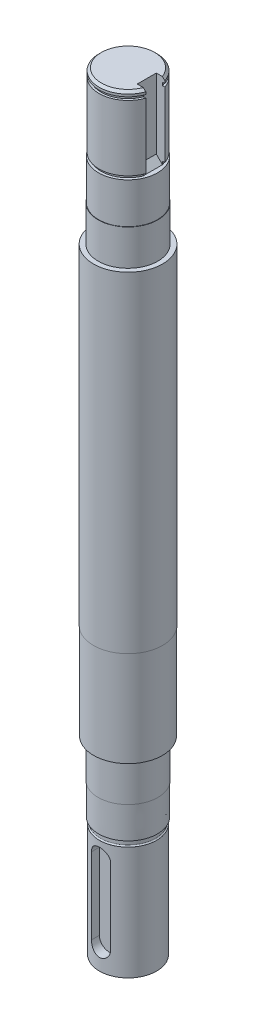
SolidWorks part; units mm, degrees
ref_plane "前视基准面" through (0, 0, 0) normal (0, 0, 1) x (1, 0, 0)
ref_plane "上视基准面" through (0, 0, 0) normal (0, 1, 0) x (1, 0, 0)
ref_plane "右视基准面" through (0, 0, 0) normal (1, 0, 0) x (0, 0, -1)
sketch "草图1" plane through (0, 0, 0) normal (0, 0, 1) x (1, 0, 0)
  line L0 (0, 326.057) -> (0, 371.1505) construction
  line L1 (0, 0) -> (12, 0)
  line L2 (12, 0) -> (12, 50)
  line L3 (12, 50) -> (12.35, 50)
  line L4 (12.5, 79.5) -> (12.5, 63.3)
  line L5 (12.5, 79.5) -> (14.4, 79.5)
  line L6 (14.5, 119.5) -> (14.5, 258)
  line L7 (14.5, 258) -> (12.5, 258)
  line L8 (12.5, 258) -> (12.5, 273)
  line L9 (14.5, 119.5) -> (14.4, 119.5)
  line L10 (14.4, 119.5) -> (14.4, 79.5)
  line L11 (12.35, 50) -> (12.3427, 63.3)
  line L12 (12.5, 63.3) -> (12.3427, 63.3)
  line L13 (12.5, 273) -> (12.35, 273)
  line L14 (12.35, 273) -> (12.35, 290)
  line L15 (12.35, 290) -> (11.2573, 290)
  line L16 (11.2573, 290) -> (11.2573, 291.3)
  line L17 (11.2573, 291.3) -> (12.15, 291.3)
  line L18 (12.15, 318.7) -> (12.15, 291.3)
  line L19 (11.25, 320) -> (11.25, 318.7)
  line L20 (11.25, 318.7) -> (12.15, 318.7)
  line L21 (12.15, 320) -> (12.15, 322)
  line L22 (12.15, 322) -> (0, 322)
  line L23 (12.15, 320) -> (11.25, 320)
  line L24 (0, 0) -> (0, 326.057) construction
  line L25 (0, 0) -> (0, 322)
  dimension "D15" = 1.3
  dimension "D1" = 12
  dimension "D2" = 30
  dimension "D3" = 32
  dimension "D4" = 12.35
  dimension "D5" = 322
  dimension "D6" = 16.2
  dimension "D7" = 12.5
  dimension "D8" = 1.3
  dimension "D9" = 12.5
  dimension "D10" = 12.35
  dimension "D11" = 15
  dimension "D12" = 40
  dimension "D13" = 178.5
  dimension "D14" = 12.15
revolve "旋转2" add sketch "草图1" angle 360 about L0
chamfer "倒角2" distance 1 angle 45 1 edges at (0, 322, -12.15)
sketch "草图5" plane through (0, 0, 0) normal (0, 0, 1) x (1, 0, 0)
  line L0 (0, 0) -> (0, 50) construction
  line L1 (-12, 50) -> (12, 50) construction
  line L2 (12, 50) -> (12, 47.5)
  line L3 (12, 0) -> (12, 50) construction
  line L4 (12, 47.5) -> (11.99, 47.5)
  line L5 (11.5, 47.99) -> (11.5, 49.51)
  line L6 (11.99, 50) -> (12, 50)
  arc A0 (11.99, 47.5) -> (11.5, 47.99) centre (11.99, 47.99) cw
  arc A1 (11.5, 49.51) -> (11.99, 50) centre (11.99, 49.51) cw
  point P16 (11.5, 50)
  dimension "D1" = 0.49
revolve "切除-旋转1" cut sketch "草图5" angle 360 about L0
ref_plane "基准面1" through (0, 0, 12) normal (0, 0, 1) x (1, 0, 0)
sketch "草图6" plane through (0, 0, 12) normal (0, 0, 1) x (1, 0, 0)
  line L0 (0, 0) -> (0, 5) construction
  line L1 (0, 5) -> (0, 25) construction
  line L2 (0, 9) -> (0, 41) construction
  line L4 (-4, 9) -> (-4, 41)
  line L5 (4, 9) -> (4, 41)
  arc A0 (-4, 9) -> (4, 9) centre (0, 9) ccw
  arc A1 (4, 41) -> (-4, 41) centre (0, 41) ccw
  point P6 (0, 45)
  point P7 (0, 5)
  point P8 (0, 25)
  dimension "D1" = 8
  dimension "D2" = 40
  dimension "D3" = 5
extrude "切除-拉伸1" cut sketch "草图6" against normal blind 4
ref_plane "基准面3" through (12.15, 0, 0) normal (1, 0, 0) x (0, 0, -1)
sketch "草图8" plane through (12.15, 0, 0) normal (1, 0, 0) x (0, 0, -1)
  line L0 (0, 290) -> (0, 322) construction
  line L1 (12.35, 290) -> (-12.35, 290) construction
  line L2 (11.15, 322) -> (-11.15, 322) construction
  line L3 (-4, 290) -> (4, 290)
  line L4 (-4, 290) -> (-4, 322)
  line L5 (-4, 322) -> (4, 322)
  line L6 (4, 290) -> (4, 322)
extrude "切除-拉伸3" cut sketch "草图8" against normal blind 4.3
chamfer "倒角3" distance 2.6 1 edges at (7.85, 290, 0)
